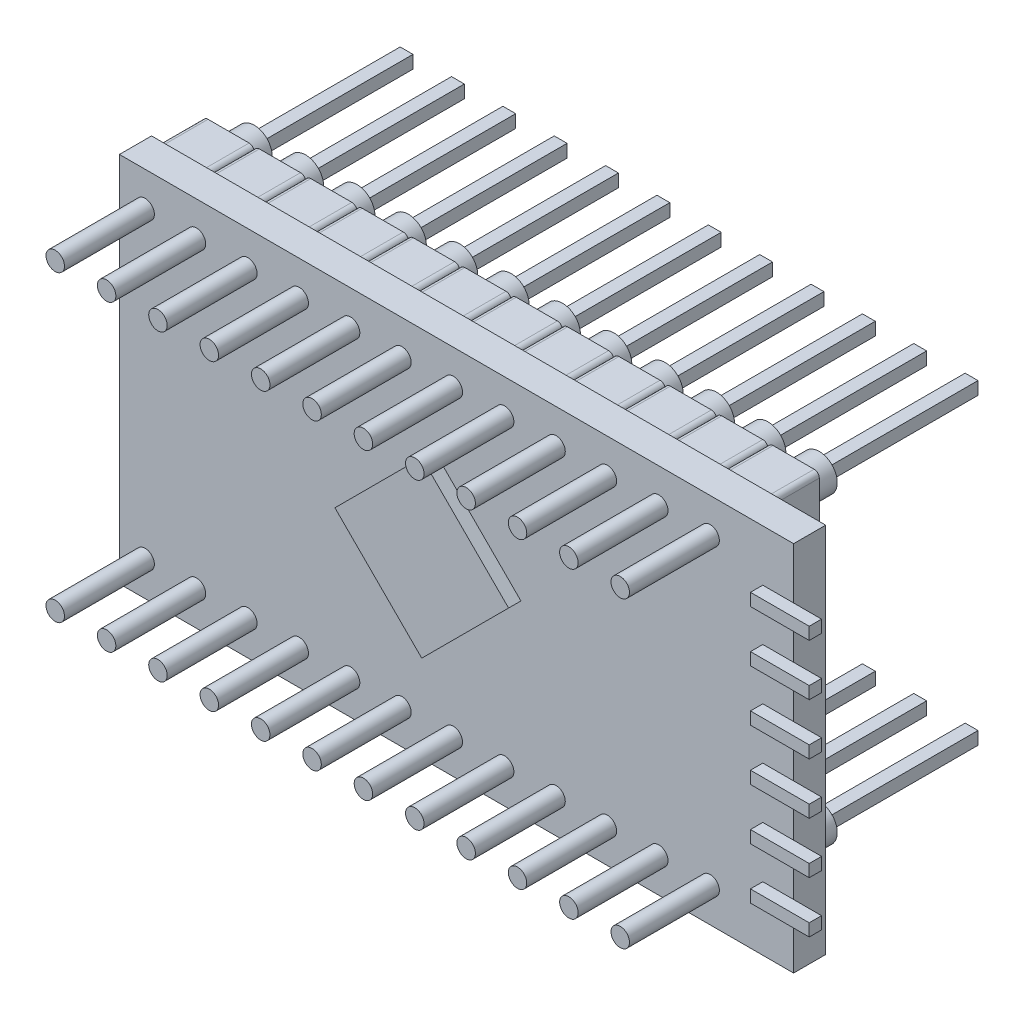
SolidWorks part; units mm, degrees
ref_plane "Front" through (0, 0, 0) normal (0, 0, 1) x (1, 0, 0)
ref_plane "Top" through (0, 0, 0) normal (0, 1, 0) x (1, 0, 0)
ref_plane "Right" through (0, 0, 0) normal (1, 0, 0) x (0, 0, -1)
sketch "Sketch1" plane through (0, 0, 0) normal (0, 0, 1) x (1, 0, 0)
  line L1 (0, -9.1948) -> (33.3375, -9.1948)
  line L2 (0, -9.1948) -> (0, 9.1948)
  line L3 (0, 9.1948) -> (33.3375, 9.1948)
  line L4 (33.3375, -9.1948) -> (33.3375, 9.1948)
  dimension "D1" = 18.3896
  dimension "D2" = 33.3375
extrude "Boss-Extrude1" add sketch "Sketch1" along normal blind 1.5875
sketch "Sketch2" plane through (0, 0, 1.5875) normal (0, 0, 1) x (1, 0, 0)
  line L0 (0, 0) -> (1.27, 0) construction
  line L1 (1.27, 7.493) -> (1.27, -7.493) construction
  circle A1 centre (1.27, -7.493) radius 0.4572
  dimension "D4" = 0.9144
  dimension "D1" = 14.986
  dimension "D2" = 1.27
extrude "Boss-Extrude2" add sketch "Sketch2" along normal blind 4.445 separate body
sketch "Sketch3" plane through (0, 0, 0) normal (0, 0, -1) x (-1, 0, 0)
  line L0 (-1.27, -8.763) -> (-1.27, -7.493) construction
  line L1 (0, -8.763) -> (-2.54, -8.763)
  line L2 (0, -8.763) -> (0, -6.223)
  line L3 (0, -6.223) -> (-2.54, -6.223)
  line L4 (-2.54, -8.763) -> (-2.54, -6.223)
  line L5 (-1.27, -7.493) -> (-2.54, -7.493) construction
  line L6 (0, 0) -> (-1.27, 0) construction
  line L7 (-1.27, 0) -> (-1.27, -7.493) construction
  dimension "D1" = 2.54
  dimension "D2" = 2.54
  dimension "D3" = 7.493
  dimension "D4" = 1.27
extrude "Boss-Extrude3" add sketch "Sketch3" along normal blind 2.54 separate body
sketch "Sketch4" plane through (0, 0, -2.54) normal (0, 0, -1) x (-1, 0, 0)
  circle A0 centre (-1.27, -7.493) radius 0.889
  circle A1 centre (-1.27, -7.493) radius 0.4572 construction
  dimension "D1" = 1.778
extrude "Boss-Extrude4" add sketch "Sketch4" along normal blind 1.27
sketch "Sketch5" plane through (0, 0, -3.81) normal (0, 0, -1) x (-1, 0, 0)
  line L1 (-0.9525, -7.1755) -> (-1.5875, -7.1755)
  line L2 (-0.9525, -7.1755) -> (-0.9525, -7.8105)
  line L3 (-0.9525, -7.8105) -> (-1.5875, -7.8105)
  line L4 (-1.5875, -7.1755) -> (-1.5875, -7.8105)
  line L5 (-0.9525, -7.1755) -> (-1.5875, -7.8105) construction
  line L6 (-0.9525, -7.8105) -> (-1.5875, -7.1755) construction
  circle A0 centre (-1.27, -7.493) radius 0.889 construction
  point P0 (-1.27, -7.493)
  dimension "D1" = 0.635
  dimension "D2" = 0.635
extrude "Boss-Extrude5" add sketch "Sketch5" along normal offset from surface (7.5311 mm away) 17.3736
fillet "Fillet3" radius 0.254 4 edges at (2.54, -8.763, -1.27) (0, -8.763, -1.27) (2.54, -6.223, -1.27) (0, -6.223, -1.27)
pattern_linear "LPattern9" count 12 spacing 2.54 along (1, 0, 0)
mirror "Mirror2" about plane through (0, 0, 0) normal (0, 1, 0)
sketch "Sketch6" plane through (0, 0, 1.5875) normal (0, 0, 1) x (1, 0, 0)
  line L0 (33.3375, 9.1948) -> (0, 9.1948) construction
  line L1 (31.8135, 6.6548) -> (41.9735, 6.6548)
  line L2 (31.8135, 6.6548) -> (31.8135, 6.0452)
  line L3 (31.8135, 6.0452) -> (41.9735, 6.0452)
  line L4 (41.9735, 6.6548) -> (41.9735, 6.0452)
  line L5 (33.3375, -9.1948) -> (33.3375, 9.1948) construction
  dimension "D1" = 10.16
  dimension "D2" = 0.6096
  dimension "D3" = 2.54
  dimension "D4" = 8.636
extrude "Boss-Extrude6" add sketch "Sketch6" along normal blind 0.6096
pattern_linear "LPattern10" count 6 spacing 2.54 along (0, -1, 0) of "Boss-Extrude6"
sketch "Sketch7" plane through (0, 0, 1.5875) normal (0, 0, 1) x (1, 0, 0)
  line L0 (19.8529, 0) -> (15.5593, 4.2937)
  line L1 (19.8529, 0) -> (15.5593, -4.2937)
  line L2 (15.5593, 4.2937) -> (11.2656, 0)
  line L3 (15.5593, -4.2937) -> (11.2656, 0)
  line L4 (19.8529, 0) -> (11.2656, 0) construction
  line L5 (15.5593, 4.2937) -> (15.5593, -4.2937) construction
  line L6 (0, 0) -> (15.5593, 0) construction
  point P1 (15.5593, 0)
extrude "Boss-Extrude7" add sketch "Sketch7" along normal blind 0.6096
sketch "Sketch8" plane through (0, 0, 2.1971) normal (0, 0, 1) x (1, 0, 0)
  line L1 (34.7196, 8.8017) -> (42.87, 8.8017)
  line L2 (34.7196, 8.8017) -> (34.7196, -9.4343)
  line L3 (34.7196, -9.4343) -> (42.87, -9.4343)
  line L4 (42.87, 8.8017) -> (42.87, -9.4343)
extrude "Cut-Extrude1" cut sketch "Sketch8" against normal blind 2.54
